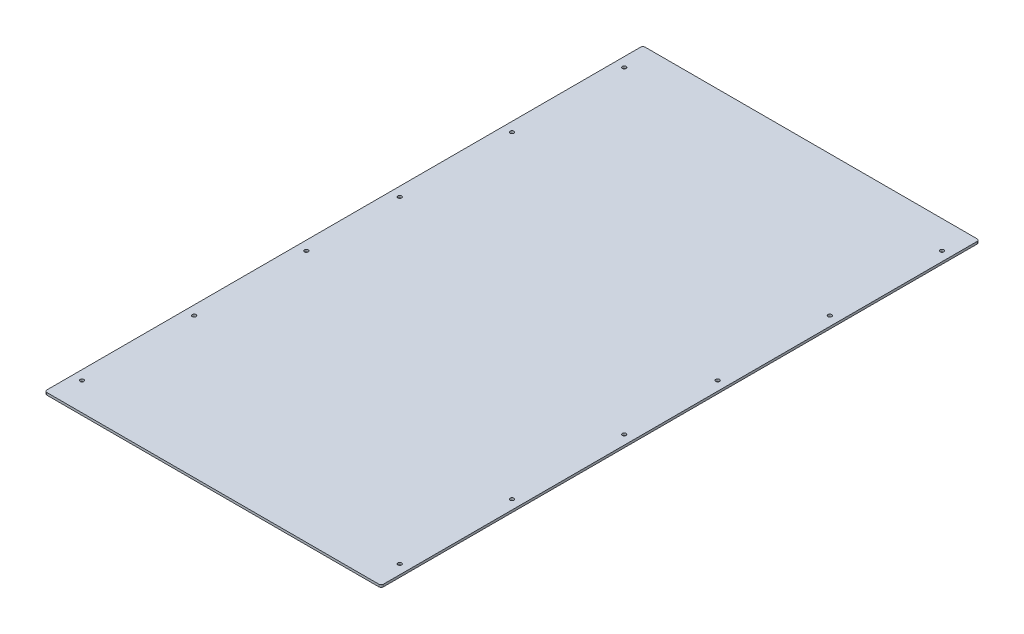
SolidWorks part; units mm, degrees
ref_plane "Front Plane" through (0, 0, 0) normal (0, 0, 1) x (1, 0, 0)
ref_plane "Top Plane" through (0, 0, 0) normal (0, 1, 0) x (1, 0, 0)
ref_plane "Right Plane" through (0, 0, 0) normal (1, 0, 0) x (0, 0, -1)
sketch "Sketch1" plane through (0, 0, 0) normal (0, 1, 0) x (1, 0, 0)
  line L1 (-228.6, -406.4) -> (228.6, -406.4)
  line L2 (-228.6, -406.4) -> (-228.6, 406.4)
  line L3 (-228.6, 406.4) -> (228.6, 406.4)
  line L4 (228.6, -406.4) -> (228.6, 406.4)
  line L5 (-228.6, -406.4) -> (228.6, 406.4) construction
  line L6 (-228.6, 406.4) -> (228.6, -406.4) construction
  point P0 (0, 0)
  dimension "D1" = 457.2
  dimension "D2" = 812.8
extrude "Boss-Extrude1" add sketch "Sketch1" along normal blind 3.175
hole_wizard "#7 (0.201) Diameter Hole1" positions "Sketch2" profile "Sketch3" hole size "#7" standard "ANSI Inch"
sketch "Sketch2" plane through (0, 3.175, 0) normal (0, 1, 0) x (1, 0, 0)
  line L0 (228.6, 406.4) -> (-228.6, 406.4) construction
  line L1 (-228.6, 406.4) -> (-228.6, -406.4) construction
  point P0 (-215.9, 368.3)
  point P13 (215.9, 368.3)
  point P19 (215.9, 215.9)
  point P25 (215.9, 63.5)
  point P30 (215.9, -63.5)
  point P36 (215.9, -215.9)
  point P42 (215.9, -368.3)
  point P50 (-215.9, 215.9)
  point P56 (-215.9, 63.5)
  point P61 (-215.9, -63.5)
  point P67 (-215.9, -215.9)
  point P73 (-215.9, -368.3)
  point P76 (-215.9, 241.3)
  point P77 (-215.9, 266.7)
  point P78 (-215.9, 292.1)
  point P79 (-215.9, 317.5)
  point P80 (-215.9, 342.9)
  point P81 (215.9, 241.3)
  point P82 (215.9, 266.7)
  point P83 (215.9, 292.1)
  point P84 (215.9, 317.5)
  point P85 (215.9, 342.9)
  point P88 (-215.9, 88.9)
  point P89 (-215.9, 114.3)
  point P90 (-215.9, 139.7)
  point P91 (-215.9, 165.1)
  point P92 (-215.9, 190.5)
  point P93 (215.9, 88.9)
  point P94 (215.9, 114.3)
  point P95 (215.9, 139.7)
  point P96 (215.9, 165.1)
  point P97 (215.9, 190.5)
  point P98 (-215.9, -342.9)
  point P99 (-215.9, -317.5)
  point P100 (-215.9, -292.1)
  point P101 (-215.9, -266.7)
  point P102 (-215.9, -241.3)
  point P103 (215.9, -342.9)
  point P104 (215.9, -317.5)
  point P105 (215.9, -292.1)
  point P106 (215.9, -266.7)
  point P107 (215.9, -241.3)
  point P108 (-215.9, -190.5)
  point P109 (-215.9, -165.1)
  point P110 (-215.9, -139.7)
  point P111 (-215.9, -114.3)
  point P112 (-215.9, -88.9)
  point P113 (215.9, -190.5)
  point P114 (215.9, -165.1)
  point P115 (215.9, -139.7)
  point P116 (215.9, -114.3)
  point P117 (215.9, -88.9)
  point P118 (-215.9, -38.1)
  point P119 (-215.9, -12.7)
  point P120 (-215.9, 12.7)
  point P121 (-215.9, 38.1)
  point P122 (215.9, -38.1)
  point P123 (215.9, -12.7)
  point P124 (215.9, 12.7)
  point P125 (215.9, 38.1)
  dimension "D1" = 38.1
  dimension "D2" = 12.7
  dimension "D5" = 152.4
  dimension "D6" = 431.8
  dimension "D3" = 2
  dimension "D4" = 30
sketch "Sketch3" plane through (-215.9, 3.175, -368.3) normal (1, 0, 0) x (0, 0, 1)
  line L0 (0, 0) -> (0, 3.175)
  line L1 (0, 3.175) -> (2.5527, 3.175)
  line L2 (2.5527, 3.175) -> (2.5527, 0)
  line L5 (2.5527, 0) -> (0, 0)
  line L11 (0, -6.35) -> (0, 107.95) construction
  dimension "Thru Hole Dia." = 5.1054
  dimension "Thru Hole Depth" = 3.175
fillet "Fillet1" radius 3.175 4 edges at (228.6, 1.5875, 406.4) (-228.6, 1.5875, 406.4) (228.6, 1.5875, -406.4) (-228.6, 1.5875, -406.4)
